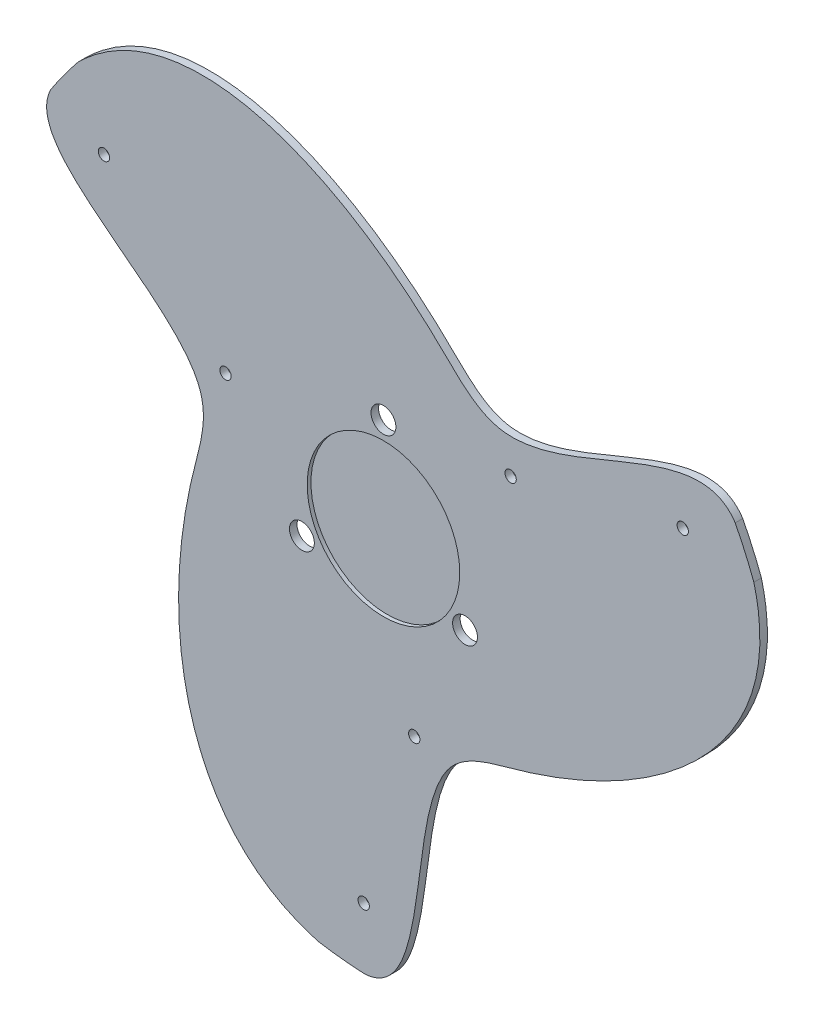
SolidWorks part; units mm, degrees
ref_plane "Face" through (0, 0, 0) normal (0, 0, 1) x (1, 0, 0)
ref_plane "Dessus" through (0, 0, 0) normal (0, 1, 0) x (1, 0, 0)
ref_plane "Droite" through (0, 0, 0) normal (1, 0, 0) x (0, 0, -1)
sketch "Esquisse1" plane through (0, 0, 0) normal (0, 0, 1) x (1, 0, 0)
  circle A0 centre (0, 0) radius 105
  dimension "D1" = 210
extrude "Extrusion1" add sketch "Esquisse1" along normal blind 2
sketch "Esquisse2" plane through (0, 0, 2) normal (0, 0, 1) x (1, 0, 0)
  circle A0 centre (0, 0) radius 20.5
  dimension "D1" = 41
sketch "Esquisse3" plane through (0, 0, 2) normal (0, 0, 1) x (1, 0, 0)
  line L0 (0, 0) -> (0, 25) construction
  line L1 (0, 0) -> (21.6506, -12.5) construction
  line L2 (0, 0) -> (-21.6506, -12.5) construction
  circle A0 centre (0, 0) radius 25 construction
  dimension "D1" = 50
  dimension "D2" = 120
  dimension "D3" = 120
hole_wizard "Dégagement M61" positions "Esquisse3D1" profile "Esquisse4" hole size "M6" standard "Ansi Métrique"
sketch3d "Esquisse3D1"
  point P0 (0, 25, 2)
  point P3 (21.6506, -12.5, 2)
  point P6 (-21.6506, -12.5, 2)
sketch "Esquisse4" plane through (0, 25, 2) normal (1, 0, 0) x (0, -1, 0)
  line L0 (0, 0) -> (0, 22.4828)
  line L1 (0, 22.4828) -> (3.3, 20.5)
  line L2 (3.3, 20.5) -> (3.3, 0)
  line L5 (3.3, 0) -> (0, 0)
  line L10 (0, 22.4828) -> (-3.3, 20.5) construction
  line L11 (0, -6.35) -> (0, 107.95) construction
  dimension "Diamètre du perçage" = 6.6
  dimension "Profondeur du perçage" = 20.5
  dimension "Angle de pointe" = 118
ref_axis "Axe1" through (0, 0, 2) along (0, 0, 1)
sketch "Esquisse6" plane through (0, 0, 0) normal (0, 0, -1) x (-1, 0, 0)
  line L0 (-94.7558, 45.2365) -> (-335.9217, 45.2365)
  line L2 (-335.9217, 45.2365) -> (181.6669, 258.4451)
  line L4 (81.0685, 66.7301) -> (181.6669, 258.4451)
  circle A1 centre (0, 0) radius 105 construction
  spline S0 degree 3 poles (81.0685, 66.7301) (54.7383, 92.7732) (7.6947, 75.4404) (-38.3171, 24.3101) (-86.7114, 66.7172) (-94.7558, 45.2365) knots 0 0 0 0 0.603262 0.703262 1 1 1 1
extrude "Extrusion3" cut sketch "Esquisse6" against normal blind 10
sketch "Esquisse8" plane through (0, 0, 2) normal (0, 0, 1) x (1, 0, 0)
  circle A0 centre (79.4484, 39.8075) radius 1.5
  dimension "D1" = 3
extrude "Enlèv. mat.-Extru.2" cut sketch "Esquisse8" against normal through all
pattern_circular "Répétition circulaire2" count 3 over 360 about axis through (0, 0, 2) along (0, 0, 1) of "Extrusion3"
sketch "Esquisse9" plane through (0, 0, 2) normal (0, 0, 1) x (1, 0, 0)
  circle A0 centre (0, 0) radius 17
  circle A1 centre (0, 0) radius 12
  dimension "D1" = 34
  dimension "D2" = 24
extrude "Extrusion4" add sketch "Esquisse9" along normal blind 4
pattern_circular "Répétition circulaire3" count 3 over 360 about axis through (0, 0, 0) along (0, 0, 1) of "Enlèv. mat.-Extru.2"
sketch "Esquisse10" plane through (0, 0, 2) normal (0, 0, 1) x (1, 0, 0)
  circle A0 centre (33.7554, 28.9241) radius 1.5
extrude "Enlèv. mat.-Extru.3" cut sketch "Esquisse10" against normal blind 3
pattern_circular "Répétition circulaire4" count 3 over 360 about axis through (0, 0, 0) along (0, 0, 1) of "Enlèv. mat.-Extru.3"
sketch "Esquisse11" plane through (0, 0, 2) normal (0, 0, 1) x (1, 0, 0)
  circle A0 centre (0, 0) radius 20.25
  dimension "D1" = 40.5
extrude "Extrusion5" cut sketch "Esquisse11" against normal blind 1 and the other way blind 10
